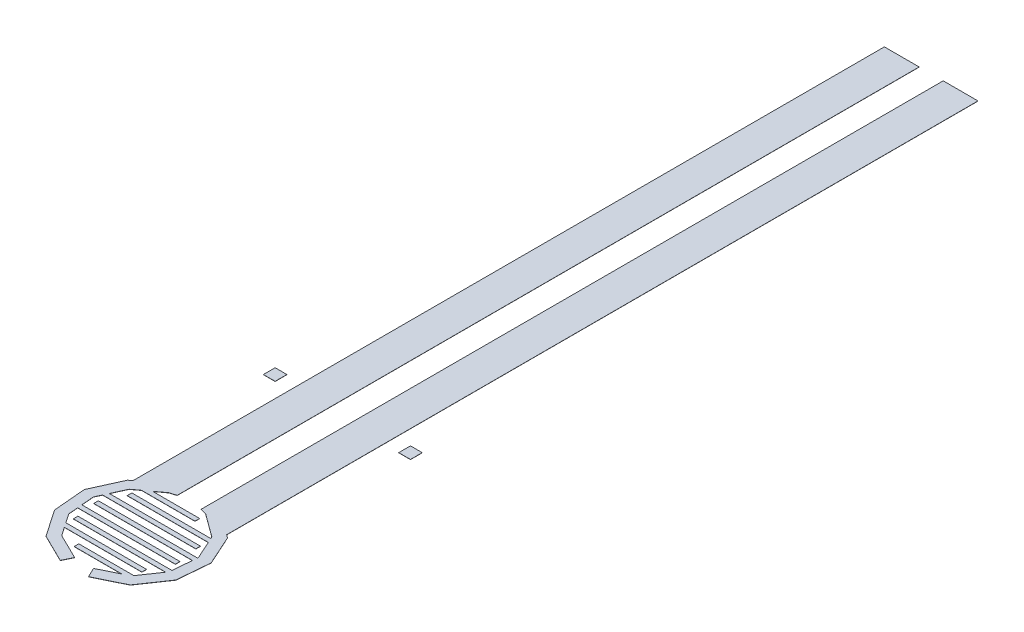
SolidWorks part; units mm, degrees
ref_plane "Front Plane" through (0, 0, 0) normal (0, 0, 1) x (1, 0, 0)
ref_plane "Top Plane" through (0, 0, 0) normal (0, 1, 0) x (1, 0, 0)
ref_plane "Right Plane" through (0, 0, 0) normal (1, 0, 0) x (0, 0, -1)
sketch "Sketch2" plane through (0, 0, 0) normal (0, 1, 0) x (1, 0, 0)
  line L0 (-3.144, 8.6323) -> (-2.636, 8.6323)
  line L1 (-3.144, 9.1403) -> (-2.636, 9.1403)
  line L2 (3.206, 8.6323) -> (2.698, 8.6323)
  line L3 (3.206, 9.1403) -> (2.698, 9.1403)
  line L4 (-3.144, 8.6323) -> (-3.144, 9.1403)
  line L5 (3.206, 8.6323) -> (3.206, 9.1403)
  line L6 (2.052, 34.2863) -> (0.55, 34.2863)
  line L7 (-0.488, 34.2863) -> (-1.99, 34.2863)
  line L8 (1.9441, 1.1663) -> (-1.556, 1.1663)
  line L9 (1.8535, 1.3663) -> (-1.556, 1.3663)
  line L10 (2.2783, 0.1503) -> (-1.985, 0.1503)
  line L11 (2.2957, 0.3503) -> (-1.985, 0.3503)
  line L12 (2.1379, -0.8657) -> (-1.8527, -0.8657)
  line L13 (2.2071, -0.6657) -> (-1.8527, -0.6657)
  line L14 (-1.4441, 1.6743) -> (0.8624, 1.6743)
  line L15 (-1.1707, 1.8743) -> (0.8624, 1.8743)
  line L16 (-2.1122, 0.6583) -> (1.9148, 0.6583)
  line L17 (-2.0216, 0.8583) -> (1.9148, 0.8583)
  line L18 (-2.1719, -0.3577) -> (2.0471, -0.3577)
  line L19 (-2.1893, -0.1577) -> (2.0471, -0.1577)
  line L20 (-1.7286, -1.3737) -> (1.6173, -1.3737)
  line L21 (-1.8653, -1.1737) -> (1.6173, -1.1737)
  line L22 (-1.99, 1.8499) -> (-2.1271, 1.7496)
  line L23 (-2.1271, 1.7496) -> (-2.7094, 0.4647)
  line L24 (-2.7094, 0.4647) -> (-2.5868, -0.9404)
  line L25 (-2.5868, -0.9404) -> (-1.79, -2.106)
  line L26 (-1.79, -2.106) -> (-0.5792, -2.7006)
  line L27 (-0.7639, 2.1719) -> (-1.1707, 1.8743)
  line L28 (-1.4441, 1.6743) -> (-1.7548, 1.4471)
  line L29 (-1.7548, 1.4471) -> (-2.0216, 0.8583)
  line L30 (-2.1122, 0.6583) -> (-2.2366, 0.3839)
  line L31 (-2.2366, 0.3839) -> (-2.1893, -0.1577)
  line L32 (-2.1719, -0.3577) -> (-2.1351, -0.7789)
  line L33 (-2.1351, -0.7789) -> (-1.8653, -1.1737)
  line L34 (-1.7286, -1.3737) -> (-1.4759, -1.7433)
  line L35 (-1.4759, -1.7433) -> (-0.3747, -2.2841)
  line L36 (1.2563, -1.8817) -> (-0.8003, -1.8817)
  line L37 (1.5801, -1.6817) -> (-0.8003, -1.6817)
  line L38 (-1.99, 34.2863) -> (-1.99, 1.8499)
  line L39 (-0.488, 34.2863) -> (-0.488, 2.2543)
  line L40 (-0.488, 2.2543) -> (-0.7639, 2.1719)
  line L41 (-0.3747, -2.2841) -> (-0.5792, -2.7006)
  line L42 (0.4368, -2.2841) -> (0.6413, -2.7006)
  line L43 (2.052, 1.8499) -> (2.1892, 1.7496)
  line L44 (2.1892, 1.7496) -> (2.7714, 0.4647)
  line L45 (2.7714, 0.4647) -> (2.6489, -0.9404)
  line L46 (2.6489, -0.9404) -> (1.8521, -2.106)
  line L47 (1.8521, -2.106) -> (0.6413, -2.7006)
  line L48 (0.826, 2.1719) -> (1.8169, 1.4471)
  line L49 (1.8169, 1.4471) -> (1.8535, 1.3663)
  line L50 (1.9441, 1.1663) -> (2.2986, 0.3839)
  line L51 (2.2986, 0.3839) -> (2.2957, 0.3503)
  line L52 (2.2783, 0.1503) -> (2.2071, -0.6657)
  line L53 (2.1379, -0.8657) -> (1.5801, -1.6817)
  line L54 (1.2563, -1.8817) -> (0.4368, -2.2841)
  line L55 (2.052, 34.2863) -> (2.052, 1.8499)
  line L56 (0.55, 34.2863) -> (0.55, 2.2543)
  line L57 (0.55, 2.2543) -> (0.826, 2.1719)
  line L58 (0.8624, 1.8743) -> (0.8624, 1.6743)
  line L59 (-1.556, 1.3663) -> (-1.556, 1.1663)
  line L60 (1.9148, 0.8583) -> (1.9148, 0.6583)
  line L61 (-1.985, 0.3503) -> (-1.985, 0.1503)
  line L62 (2.0471, -0.1577) -> (2.0471, -0.3577)
  line L63 (-1.8527, -0.6657) -> (-1.8527, -0.8657)
  line L64 (1.6173, -1.1737) -> (1.6173, -1.3737)
  line L65 (-0.8003, -1.6817) -> (-0.8003, -1.8817)
  line L66 (-2.636, 9.1403) -> (-2.636, 8.6323)
  line L67 (2.698, 9.1403) -> (2.698, 8.6323)
extrude "Extrude1" add sketch "Sketch2" along normal blind 0.007
